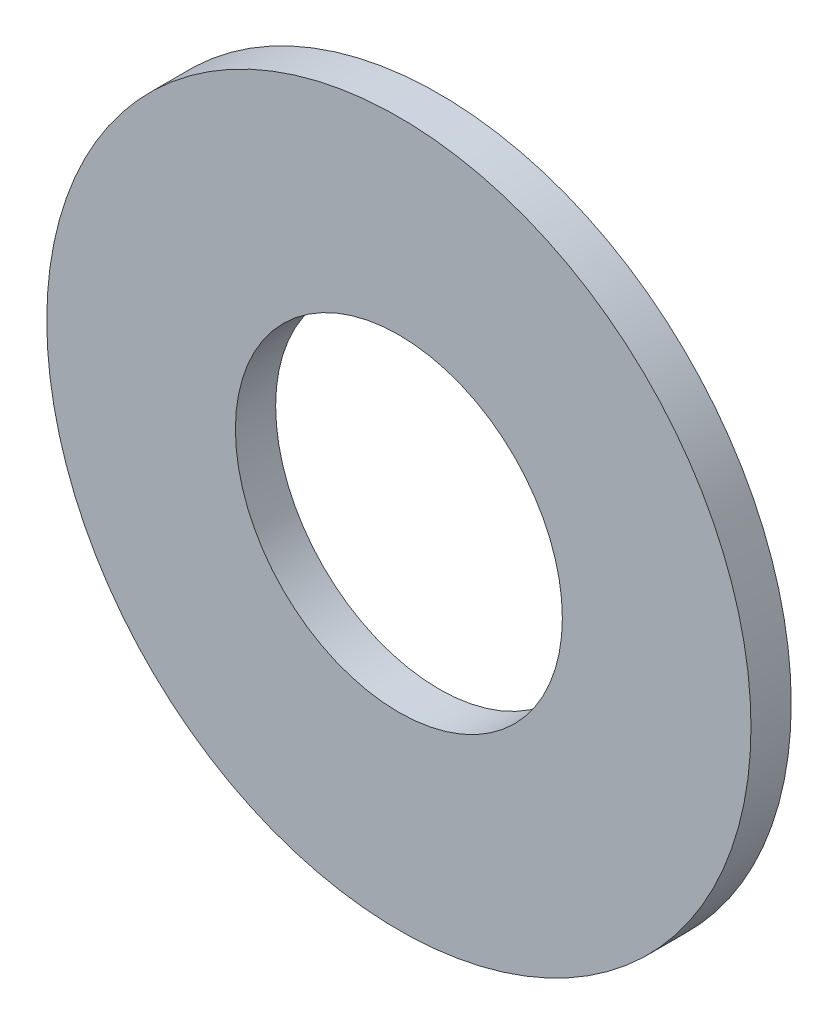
SolidWorks part; units mm, degrees
ref_plane "Front" through (0, 0, 0) normal (0, 0, 1) x (1, 0, 0)
ref_plane "Top" through (0, 0, 0) normal (0, 1, 0) x (1, 0, 0)
ref_plane "Right" through (0, 0, 0) normal (1, 0, 0) x (0, 0, -1)
sketch "Sketch1" plane through (0, 0, 0) normal (0, 0, 1) x (1, 0, 0)
  circle A0 centre (0, 0) radius 5.1594
  circle A1 centre (0, 0) radius 11.1125
  dimension "D1" = 10.3187
  dimension "D2" = 22.225
extrude "Extrude1" add sketch "Sketch1" along normal blind 1.27
